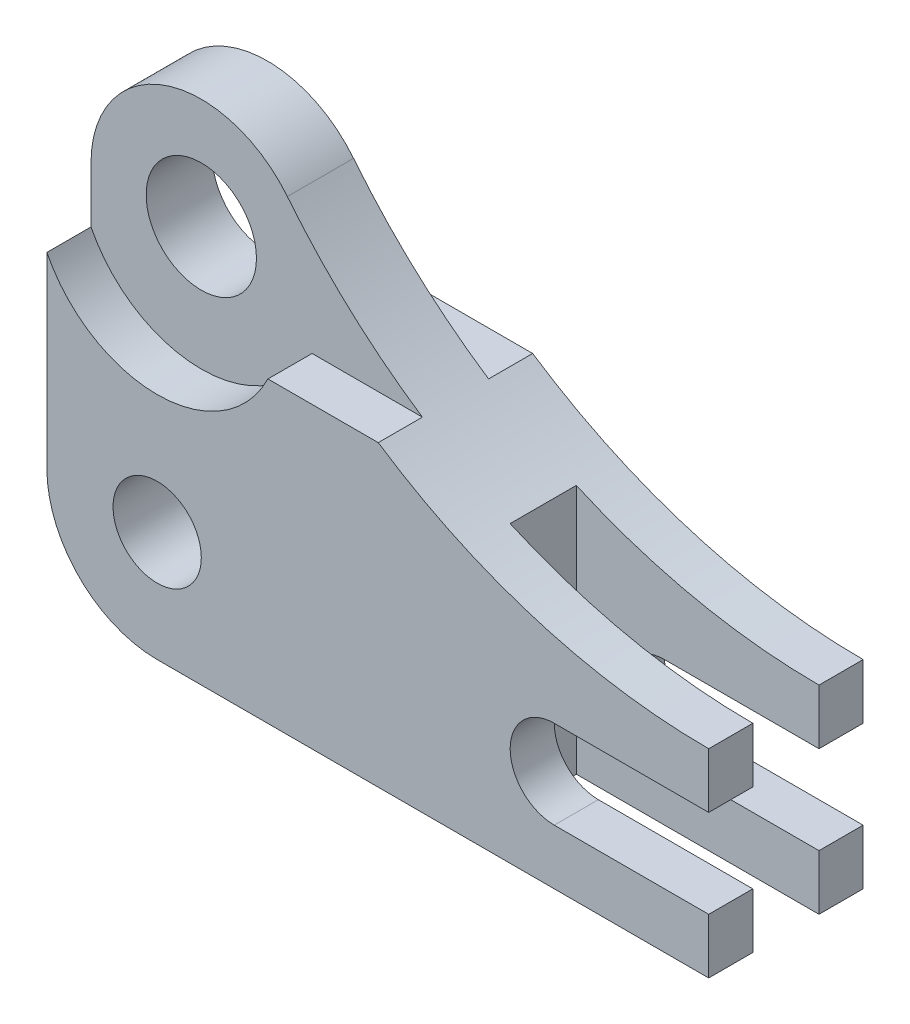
SolidWorks part; units mm, degrees
ref_plane "Front Plane" through (0, 0, 0) normal (0, 0, 1) x (1, 0, 0)
ref_plane "Top Plane" through (0, 0, 0) normal (0, 1, 0) x (1, 0, 0)
ref_plane "Right Plane" through (0, 0, 0) normal (1, 0, 0) x (0, 0, -1)
sketch "Sketch1" plane through (0, 0, 0) normal (0, 0, 1) x (1, 0, 0)
  line L0 (0, 25) -> (0, 80)
  line L1 (150, 45) -> (150, 32.5)
  line L2 (150, 0) -> (25, 0)
  line L3 (150, 22.5) -> (115, 22.5) construction
  line L4 (150, 32.5) -> (115, 32.5)
  line L5 (150, 12.5) -> (115, 12.5)
  line L6 (150, 12.5) -> (150, 0)
  arc A0 (150, 45) -> (44.5059, 95.6372) centre (150, 180.2083) cw
  arc A1 (44.5059, 95.6372) -> (0, 80) centre (25, 80) ccw
  arc A2 (0, 25) -> (25, 0) centre (25, 25) ccw
  circle A3 centre (25, 25) radius 10
  arc A4 (115, 32.5) -> (115, 12.5) centre (115, 22.5) ccw
  point P10 (0, 0)
  dimension "D1" = 80
  dimension "D3" = 45
  dimension "D4" = 25
  dimension "D5" = 25
  dimension "D6" = 20
  dimension "D8" = 10
  dimension "D2" = 150
  dimension "D7" = 35
extrude "Extrude1" add sketch "Sketch1" along normal mid plane 35
sketch "Sketch2" plane through (0, 0, 17.5) normal (0, 0, 1) x (1, 0, 0)
  line L0 (0, 80) -> (0, 67.4231)
  line L1 (50.1066, 67.6372) -> (75.1066, 67.6372)
  arc A0 (0, 67.4231) -> (50.1066, 67.6372) centre (25, 80) ccw
  arc A1 (44.5059, 95.6372) -> (150, 45) centre (150, 180.2083) ccw construction
  arc A2 (44.5059, 95.6372) -> (0, 80) centre (25, 80) ccw construction
  arc A3 (44.5059, 95.6372) -> (0, 80) centre (25, 80) ccw
  arc A4 (44.5059, 95.6372) -> (75.1066, 67.6372) centre (150, 180.2083) ccw
  dimension "D1" = 27.9853
  dimension "D2" = 25
extrude "Cut-Extrude1" cut sketch "Sketch2" against normal blind 10
mirror "Mirror1" about plane through (0, 0, 0) normal (0, 0, 1) of "Cut-Extrude1"
sketch "Sketch3" plane through (0, 0, 7.5) normal (0, 0, 1) x (1, 0, 0)
  circle A0 centre (25, 80) radius 12.5
  dimension "D1" = 25
extrude "Cut-Extrude2" cut sketch "Sketch3" against normal through all
sketch "Sketch4" plane through (0, 0, 0) normal (0, 1, 0) x (1, 0, 0)
  line L0 (150, 0) -> (95, 0) construction
  line L1 (150, -17.5) -> (150, 17.5) construction
  line L2 (150, 7.5) -> (95, 7.5)
  line L3 (150, -7.5) -> (95, -7.5)
  line L4 (95, 7.5) -> (95, -7.5)
  line L5 (150, 7.5) -> (150, -7.5)
  dimension "D1" = 55
  dimension "D2" = 15
extrude "Cut-Extrude4" cut sketch "Sketch4" along normal blind 60 and the other way blind 30
